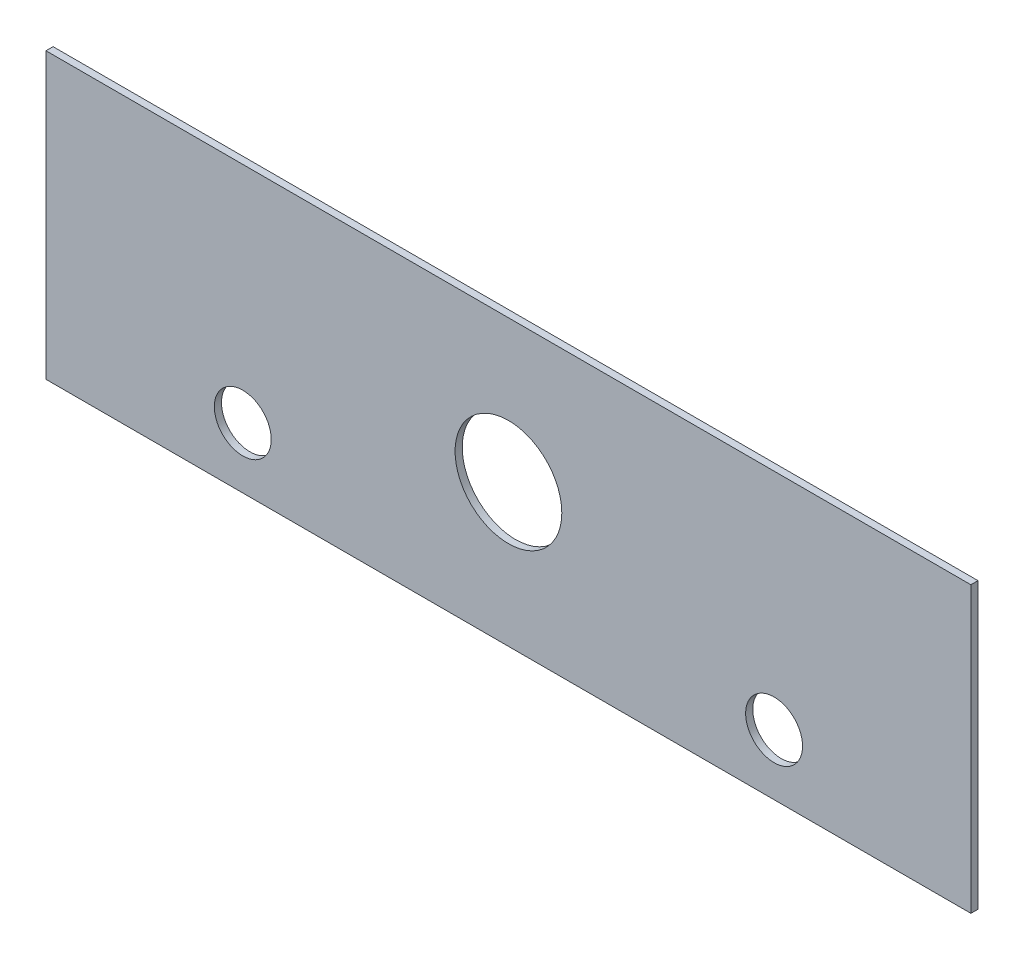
SolidWorks part; units mm, degrees
ref_plane "Piano frontale" through (0, 0, 0) normal (0, 0, 1) x (1, 0, 0)
ref_plane "Piano superiore" through (0, 0, 0) normal (0, 1, 0) x (1, 0, 0)
ref_plane "Piano destro" through (0, 0, 0) normal (1, 0, 0) x (0, 0, -1)
sketch "Schizzo1" plane through (0, 0, 0) normal (0, 0, 1) x (1, 0, 0)
  line L1 (-65, -20) -> (65, -20)
  line L2 (-65, -20) -> (-65, 20)
  line L3 (-65, 20) -> (65, 20)
  line L4 (65, -20) -> (65, 20)
  line L5 (-65, -20) -> (65, 20) construction
  line L6 (-65, 20) -> (65, -20) construction
  circle A0 centre (0, 0) radius 7.5
  circle A1 centre (-37.341, -11.4895) radius 4
  circle A2 centre (37.341, -11.4895) radius 4
  point P0 (0, 0)
  dimension "D3" = 15
  dimension "D4" = 8
  dimension "D5" = 8
  dimension "D1" = 130
  dimension "D2" = 40
extrude "Estrusione-Estrusione1" add sketch "Schizzo1" along normal blind 1
